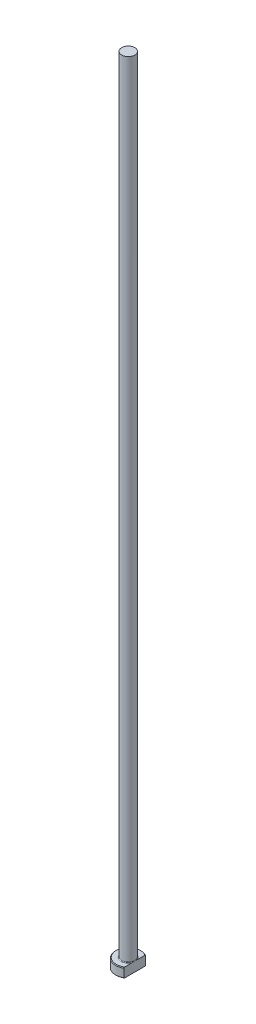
SolidWorks part; units mm, degrees
ref_plane "Front Plane" through (0, 0, 0) normal (0, 0, 1) x (1, 0, 0)
ref_plane "Top Plane" through (0, 0, 0) normal (0, 1, 0) x (1, 0, 0)
ref_plane "Right Plane" through (0, 0, 0) normal (1, 0, 0) x (0, 0, -1)
sketch "Sketch1" plane through (0, 0, 0) normal (0, 0, 1) x (1, 0, 0)
  line L0 (0, 259.9588) -> (0, -15.1925) construction
  line L1 (0, 0) -> (-4, 0)
  line L2 (-4, 0) -> (-4, 3)
  line L3 (-4, 3) -> (-2.05, 3)
  line L4 (-2.05, 3) -> (-2.05, 250)
  line L5 (-2.05, 250) -> (0, 250)
  line L6 (0, 250) -> (0, 0)
  dimension "L" = 250
  dimension "H" = 8
  dimension "T" = 3
  dimension "D" = 4.1
revolve "Revolve1" add sketch "Sketch1" angle 360 about L0
chamfer "Chamfer1" distance 0.2 angle 45 2 edges at (0, 3, 4) (0, 0, 4)
fillet "Fillet1" radius 0.2 1 edges at (0, 3, 2.05)
sketch "Sketch2" plane through (0, 0, 0) normal (0, 1, 0) x (1, 0, 0)
  line L0 (2.05, 3.4347) -> (2.05, -3.4347)
  circle A0 centre (0, 0) radius 4 construction
  arc A1 (2.05, -3.4347) -> (2.05, 3.4347) centre (0, 0) ccw
  circle A2 centre (0, 0) radius 2.05 construction
extrude "KEY" cut sketch "Sketch2" along normal through all
